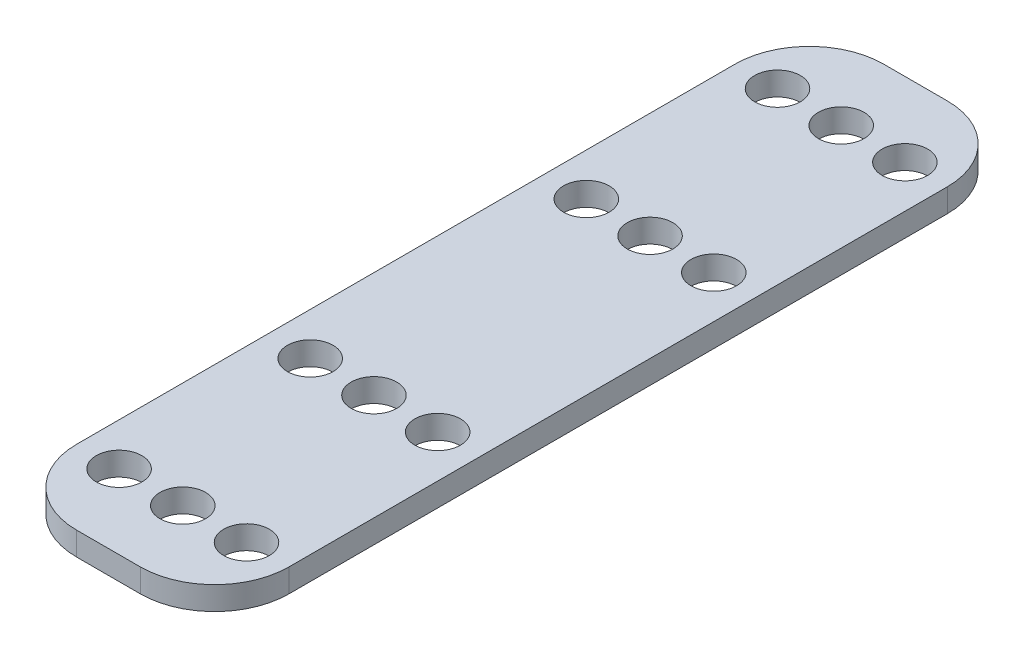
SolidWorks part; units mm, degrees
ref_plane "Front Plane" through (0, 0, 0) normal (0, 0, 1) x (1, 0, 0)
ref_plane "Top Plane" through (0, 0, 0) normal (0, 1, 0) x (1, 0, 0)
ref_plane "Right Plane" through (0, 0, 0) normal (1, 0, 0) x (0, 0, -1)
sketch "Sketch1" plane through (0, 0, 0) normal (0, 1, 0) x (1, 0, 0)
  line L0 (4, 69) -> (10, 69) construction
  line L1 (7, 0) -> (13, 0)
  line L2 (0, 7) -> (0, 69)
  line L3 (7, 76) -> (13, 76)
  line L4 (20, 7) -> (20, 69)
  line L5 (4, 69) -> (4, 51) construction
  line L6 (0, 38) -> (20, 38) construction
  arc A0 (7, 0) -> (0, 7) centre (7, 7) cw
  arc A1 (13, 0) -> (20, 7) centre (13, 7) ccw
  arc A2 (13, 76) -> (20, 69) centre (13, 69) cw
  arc A3 (0, 69) -> (7, 76) centre (7, 69) cw
  circle A4 centre (4, 69) radius 2.15
  circle A5 centre (10, 69) radius 2.15
  circle A6 centre (16, 69) radius 2.15
  circle A7 centre (10, 51) radius 2.15
  circle A8 centre (16, 51) radius 2.15
  circle A9 centre (4, 51) radius 2.15
  circle A10 centre (16, 7) radius 2.15
  circle A11 centre (10, 7) radius 2.15
  circle A12 centre (4, 7) radius 2.15
  circle A13 centre (4, 25) radius 2.15
  circle A14 centre (10, 25) radius 2.15
  circle A15 centre (16, 25) radius 2.15
  point P7 (0, 0)
  point P10 (20, 0)
  point P13 (20, 76)
  dimension "D3" = 7
  dimension "D4" = 4.3
  dimension "D11" = 4
  dimension "D1" = 76
  dimension "D2" = 20
  dimension "D5" = 7
  dimension "D6" = 4
  dimension "D9" = 6
  dimension "D10" = 18
  dimension "D7" = 3
  dimension "D8" = 2
extrude "Boss-Extrude1" add sketch "Sketch1" along normal blind 2.2
